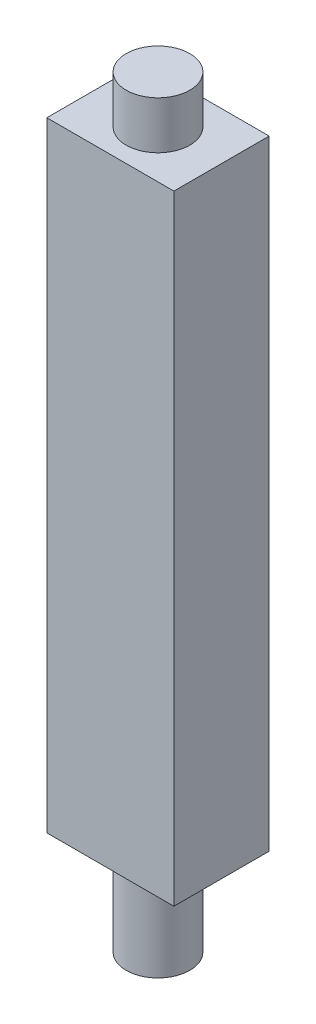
SolidWorks part; units mm, degrees
ref_plane "Front Plane" through (0, 0, 0) normal (0, 0, 1) x (1, 0, 0)
ref_plane "Top Plane" through (0, 0, 0) normal (0, 1, 0) x (1, 0, 0)
ref_plane "Right Plane" through (0, 0, 0) normal (1, 0, 0) x (0, 0, -1)
sketch "Sketch1" plane through (0, 0, 0) normal (0, 1, 0) x (1, 0, 0)
  circle A0 centre (0, 0) radius 1
  dimension "D1" = 2
extrude "Boss-Extrude1" add sketch "Sketch1" along normal blind 3
sketch "Sketch2" plane through (0, 3, 0) normal (0, 1, 0) x (1, 0, 0)
  line L1 (-2, -1.5) -> (2, -1.5)
  line L2 (-2, -1.5) -> (-2, 1.5)
  line L3 (-2, 1.5) -> (2, 1.5)
  line L4 (2, -1.5) -> (2, 1.5)
  line L5 (-2, -1.5) -> (2, 1.5) construction
  line L6 (-2, 1.5) -> (2, -1.5) construction
  point P0 (0, 0)
  dimension "D1" = 4
  dimension "D2" = 3
extrude "Boss-Extrude2" add sketch "Sketch2" along normal blind 19.5
sketch "Sketch3" plane through (0, 22.5, 0) normal (0, 1, 0) x (1, 0, 0)
  circle A0 centre (0, 0) radius 1
  dimension "D1" = 2
extrude "Boss-Extrude3" add sketch "Sketch3" along normal blind 1.5
sketch "Sketch4" plane through (0, 24, 0) normal (0, 1, 0) x (1, 0, 0)
  line L0 (0, 0) -> (0, 1) construction
  circle A0 centre (0, 0) radius 1 construction
